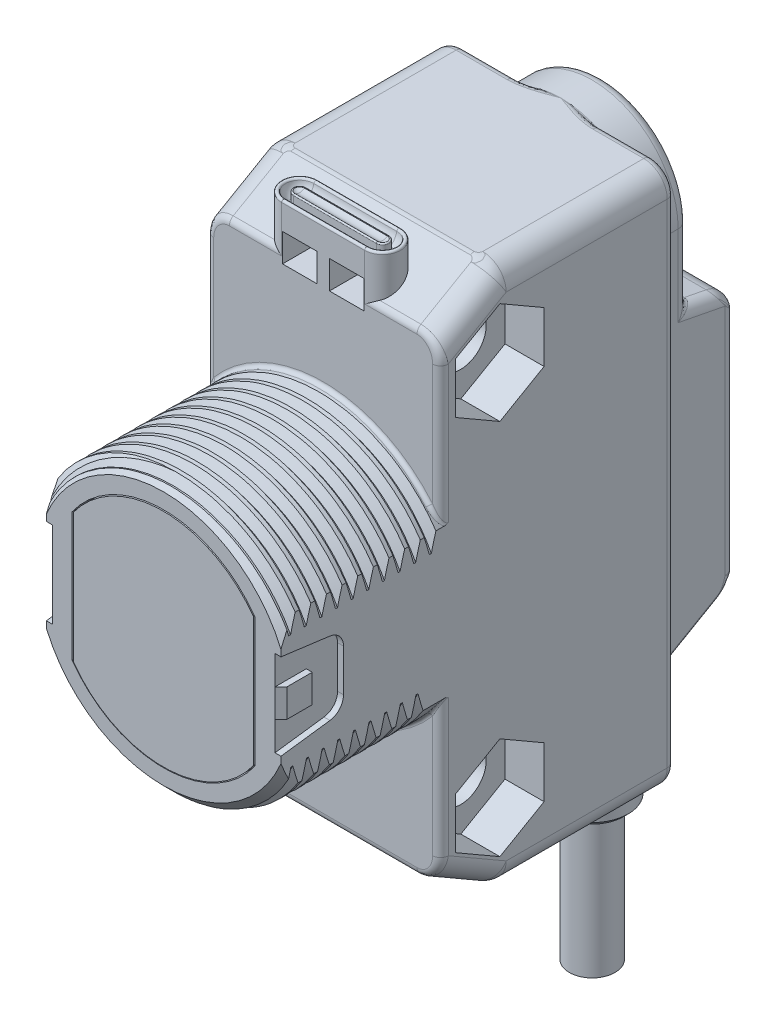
SolidWorks part; units mm, degrees
ref_plane "Front Plane" through (0, 0, 0) normal (0, 0, 1) x (1, 0, 0)
ref_plane "Top Plane" through (0, 0, 0) normal (0, 1, 0) x (1, 0, 0)
ref_plane "Right Plane" through (0, 0, 0) normal (1, 0, 0) x (0, 0, -1)
imported_body "Imported1"
imported_body "Imported2"
sketch "Sketch1" plane through (0, -56.85, 0) normal (0, -1, 0) x (1, 0, 0)
  circle A0 centre (0, -9.5) radius 1.4605 construction
  circle A1 centre (0, -9.5) radius 1.4605
extrude "Cut-Extrude1" cut sketch "Sketch1" against normal blind 25.4
